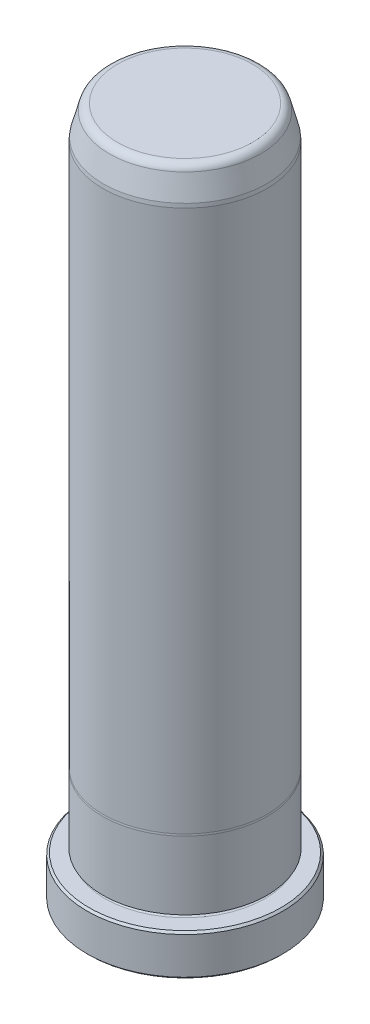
SolidWorks part; units mm, degrees
ref_plane "Front Plane" through (0, 0, 0) normal (0, 0, 1) x (1, 0, 0)
ref_plane "Top Plane" through (0, 0, 0) normal (0, 1, 0) x (1, 0, 0)
ref_plane "Right Plane" through (0, 0, 0) normal (1, 0, 0) x (0, 0, -1)
sketch "Sketch1" plane through (0, 0, 0) normal (1, 0, 0) x (0, 0, -1)
  line L0 (0, 0) -> (18.923, 0)
  line L1 (18.923, 0) -> (18.923, 7.9248)
  line L2 (18.923, 7.9248) -> (15.4813, 7.9248)
  line L3 (15.1003, 4.7498) -> (15.1003, 5.5118) construction
  line L4 (15.4813, 8.6868) -> (15.8877, 8.6868)
  line L5 (15.8877, 8.6868) -> (15.8877, 21.8618)
  line L6 (15.8877, 21.8618) -> (15.8623, 22.225)
  line L7 (15.8623, 22.225) -> (15.8623, 127)
  line L9 (14.2983, 133.35) -> (0, 133.35)
  line L10 (0, 133.35) -> (0, 0)
  line L11 (0, 0) -> (0, -13.6287) construction
  line L12 (15.8623, 127) -> (15.7956, 127.762)
  line L13 (15.7956, 127.762) -> (14.2983, 133.35)
  arc A0 (15.4813, 8.6868) -> (15.4813, 7.9248) centre (15.4813, 8.3058) ccw
  dimension "D14" = 0.762
  dimension "T" = 7.9248
  dimension "D2" = 0.762
  dimension "M" = 37.846
  dimension "B" = 31.7754
  dimension "L" = 133.35
  dimension "D7" = 0.7874
  dimension "A" = 22.225
  dimension "D8" = 4
  dimension "D10" = 5
  dimension "D11" = 15
  dimension "D12" = 0.762
  dimension "K" = 6.35
  dimension "D" = 31.7246
revolve "Revolve1" add sketch "Sketch1" angle 360 about L11
fillet "Fillet6" radius 1.5875 1 edges at (0, 133.35, 14.2983)
chamfer "Chamfer1" distance 0.381 angle 45 2 edges at (0, 0, 18.923) (0, 7.9248, 18.923)
